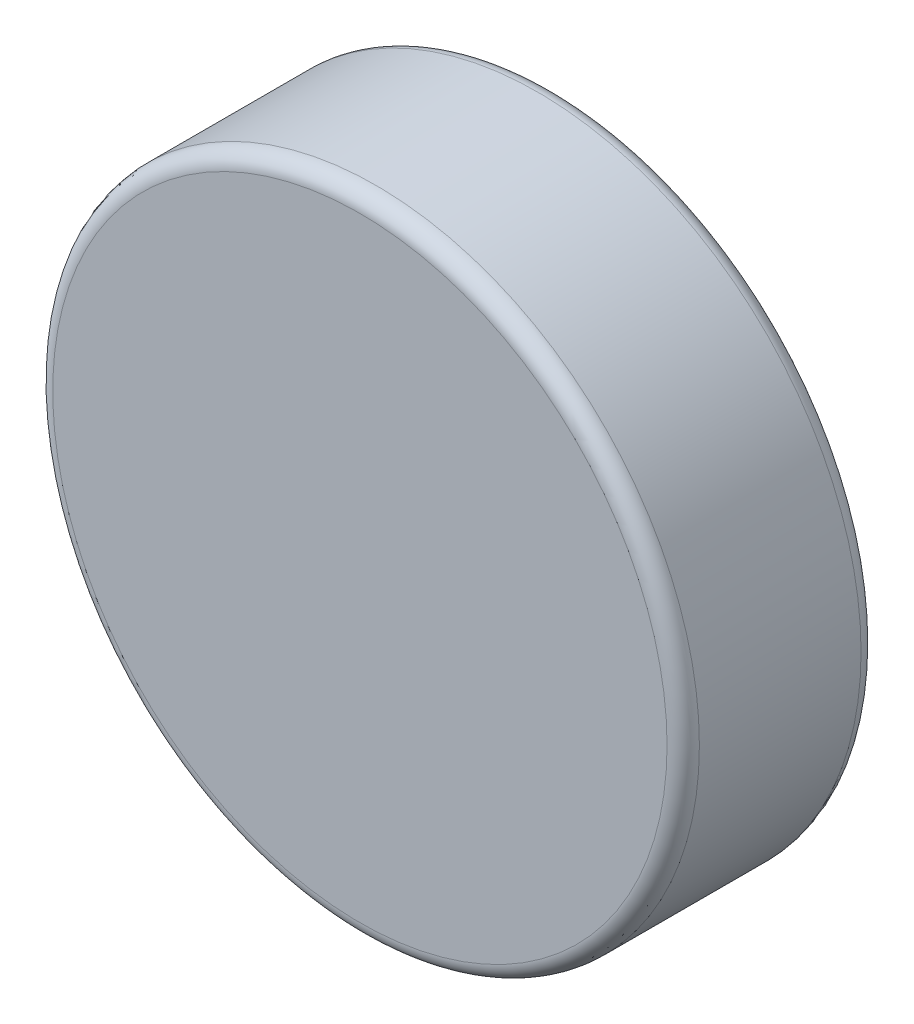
SolidWorks part; units mm, degrees
ref_plane "Front" through (0, 0, 0) normal (0, 0, 1) x (1, 0, 0)
ref_plane "Top" through (0, 0, 0) normal (0, 1, 0) x (1, 0, 0)
ref_plane "Right" through (0, 0, 0) normal (1, 0, 0) x (0, 0, -1)
sketch "Esquisse1" plane through (0, 0, 0) normal (0, 0, 1) x (1, 0, 0)
  circle A0 centre (0, 0) radius 5
  dimension "D1" = 10
extrude "Boss.-Extru.1" add sketch "Esquisse1" along normal blind 3
fillet "Congé1" radius 0.25 2 edges at (5, 0, 0) (5, 0, 3)
